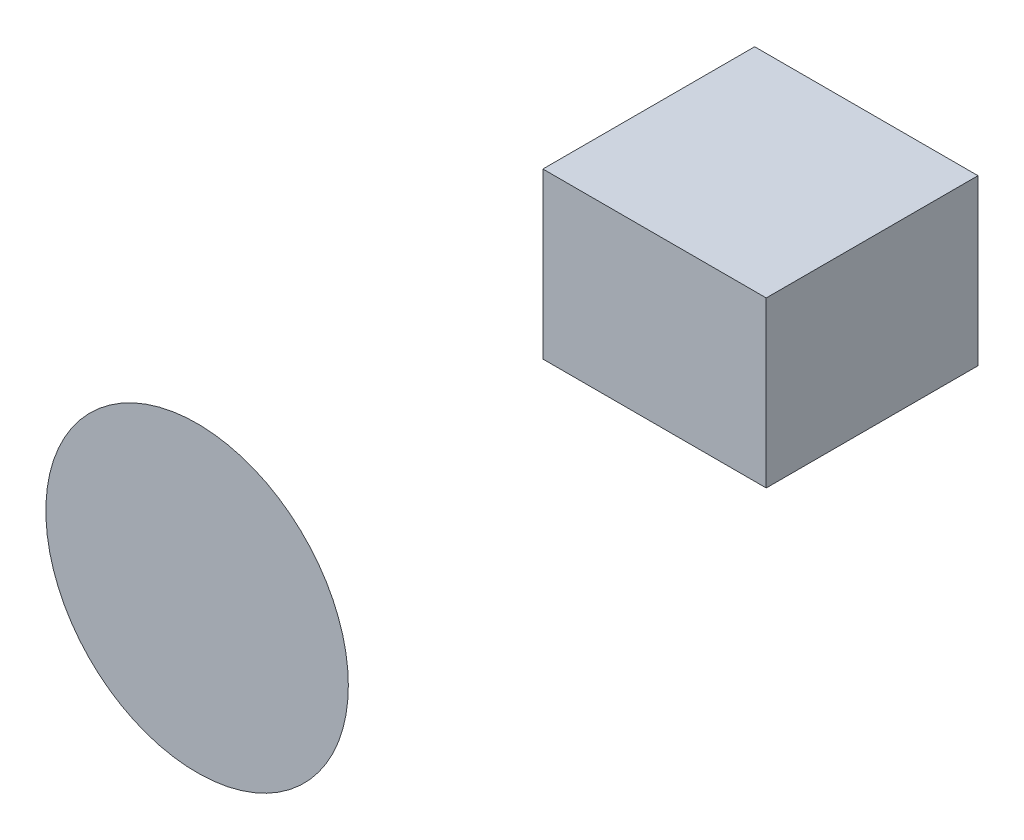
SolidWorks part; units mm, degrees
ref_plane "Front Plane" through (0, 0, 0) normal (0, 0, 1) x (1, 0, 0)
ref_plane "Top Plane" through (0, 0, 0) normal (0, 1, 0) x (1, 0, 0)
ref_plane "Right Plane" through (0, 0, 0) normal (1, 0, 0) x (0, 0, -1)
sketch "Sketch1" plane through (0, 0, 0) normal (0, 0, 1) x (1, 0, 0)
  line L1 (0, 0) -> (80.095, 0)
  line L2 (0, 0) -> (0, 59.0315)
  line L3 (0, 59.0315) -> (80.095, 59.0315)
  line L4 (80.095, 0) -> (80.095, 59.0315)
extrude "Extrude1" add sketch "Sketch1" against normal blind 75.946
ref_plane "Plane1" through (0, 0, 161.9009) normal (0, 0, 1) x (1, 0, 0)
ref_plane "Plane2" through (0, 0, 283.1617) normal (0, 0, 1) x (1, 0, 0)
ref_plane "Plane3" through (0, 0, 429.8226) normal (0, 0, 1) x (1, 0, 0)
sketch "Sketch2" plane through (0, 0, 161.9009) normal (0, 0, 1) x (1, 0, 0)
  circle A0 centre (37.8923, 25.6774) radius 54.2408
surface "Surface-Plane1" sketch "Sketch2"
sketch "Sketch3" plane through (0, 0, 283.1617) normal (0, 0, 1) x (1, 0, 0)
  spline S0 degree 3 poles (-27.0707, 29.2873) (-13.3513, 52.0046) (16.4074, 101.2804) (61.2979, 62.4723) (85.4929, 41.5556) knots 0 0 0 0 0.461023 1 1 1 1
  spline S1 degree 3 poles (85.4929, 41.5556) (68.315, 28.1906) (43.3088, 8.735) (59.9728, -13.8158) (65.1895, -20.8754) knots 0 0 0 0 0.686948 1 1 1 1
  spline S2 degree 3 poles (-27.0707, 29.2873) (-18.1495, 17.244) (1.061, -8.6896) (-29.8152, -21.0266) (-46.3529, -27.6344) knots 0 0 0 0 0.464389 1 1 1 1
  spline S3 degree 3 poles (-46.3529, -27.6344) (-29.6333, -37.1704) (7.9197, -58.5889) (44.7545, -34.3323) (65.1895, -20.8754) knots 0 0 0 0 0.445225 1 1 1 1
sketch "Sketch4" plane through (0, 0, 429.8226) normal (0, 0, 1) x (1, 0, 0)
  point P0 (30.5108, 27.32)
